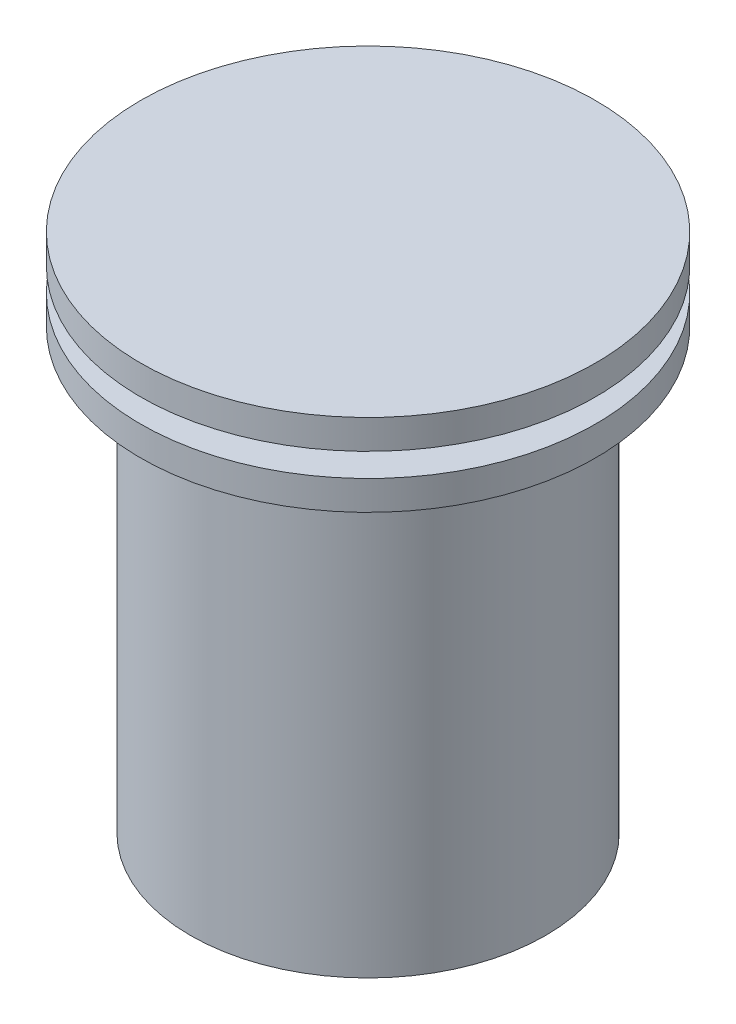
SolidWorks part; units mm, degrees
ref_plane "Alzado" through (0, 0, 0) normal (0, 0, 1) x (1, 0, 0)
ref_plane "Planta" through (0, 0, 0) normal (0, 1, 0) x (1, 0, 0)
ref_plane "Vista lateral" through (0, 0, 0) normal (1, 0, 0) x (0, 0, -1)
sketch "Croquis1" plane through (0, 0, 0) normal (0, 0, 1) x (1, 0, 0)
  line L0 (0, 135.5388) -> (0, -57.4612)
  line L2 (60.5, -41.8447) -> (60.5, 107.5388)
  line L3 (0, 135.5388) -> (77.5, 135.5388)
  line L4 (77.5, 135.5388) -> (77.5, 125.5388)
  line L5 (77.5, 125.5388) -> (60.5, 125.5388)
  line L6 (60.5, 125.5388) -> (60.5, 117.5388)
  line L7 (60.5, 117.5388) -> (77.5, 117.5388)
  line L8 (77.5, 117.5388) -> (77.5, 107.5388)
  line L9 (77.5, 107.5388) -> (60.5, 107.5388)
  arc A0 (0, -57.4612) -> (60.5, -41.8447) centre (0, 67.5388) ccw
  dimension "D7" = 250
  dimension "D3" = 125
  dimension "D1" = 193
  dimension "D2" = 149.3835
  dimension "D4" = 77.5
  dimension "D5" = 10
  dimension "D6" = 10
revolve "Revolución1" add sketch "Croquis1" angle 360 about L0
ref_plane "Plano1" through (0, 0, 0) normal (0, 1, 0) x (-1, 0, 0)
